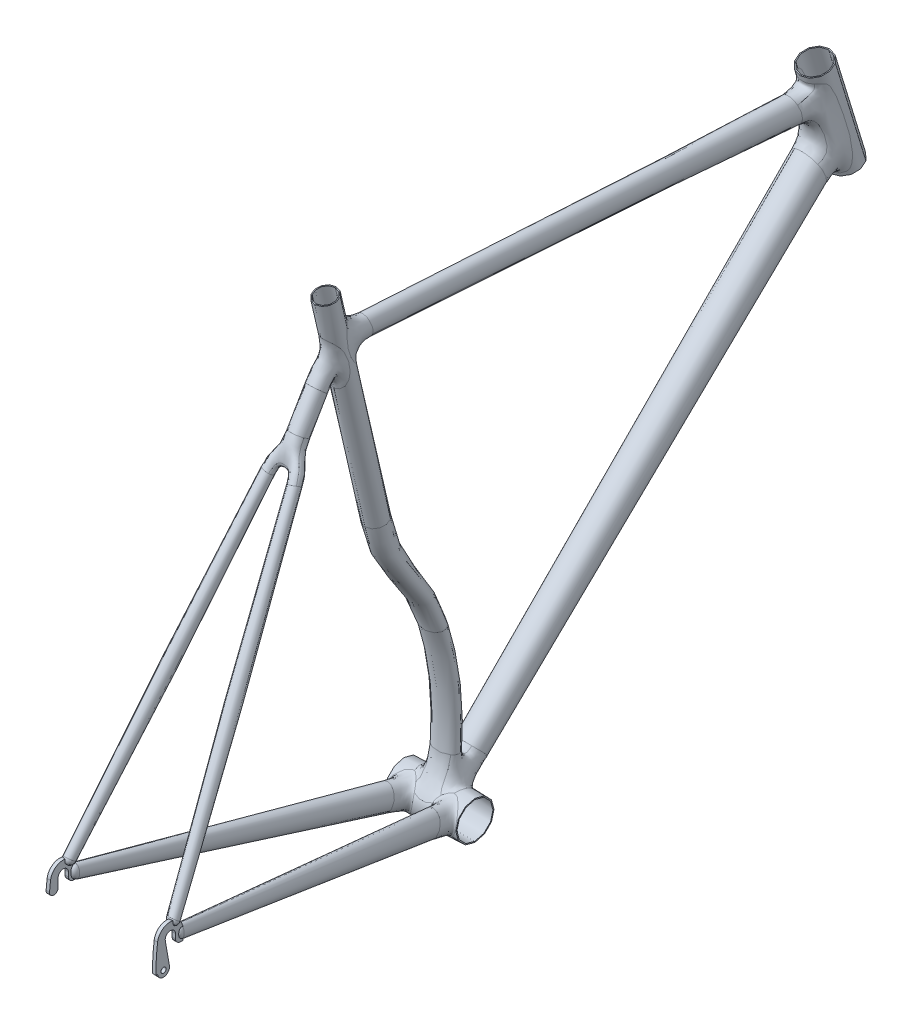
SolidWorks part; units mm, degrees
other "Dropout, Right"
other "Dropout, Left"
other "Head Tube"
other "Down Tube"
other "Seat Tube, Upper "
other "Seat Tube, Lower "
other "Bottom Bracket"
other "Top Tube"
other "Seat Stay, Left"
other "Seat Stay, Right"
other "Chain Stay, Left"
other "Chain Stay, Right"
ref_plane "Front Plane" through (0, 0, 0) normal (0, 0, 1) x (1, 0, 0)
ref_plane "Top Plane" through (0, 0, 0) normal (0, 1, 0) x (1, 0, 0)
ref_plane "Right Plane" through (0, 0, 0) normal (1, 0, 0) x (0, 0, -1)
sketch "Tube Centerlines" plane through (0, 0, 0) normal (1, 0, 0) x (0, 0, -1)
  line L0 (378.0551, 266.7) -> (837.7165, 719.7458)
  line L1 (378.0551, 266.7) -> (435.3368, 463.7667) construction
  line L2 (851.0837, 676.0236) -> (815.4378, 792.6162)
  line L3 (378.0551, 266.7) -> (0, 350)
  line L4 (0, 350) -> (256.6378, 792.6162)
  line L5 (256.6378, 792.6162) -> (826.5771, 756.181)
  line L6 (256.6378, 792.6162) -> (378.0551, 266.7) construction
  line L7 (0, 55) -> (0, -55) construction
  dimension "D1" = 45.72
  dimension "D2" = 38.1
  dimension "D3" = 38.1
  dimension "D4" = 72.32
  dimension "D5" = 116.448
  dimension "D6" = 122.989
  dimension "D7" = 539.75
  dimension "D8" = 17
imported_body "Tube Cap 1"
imported_body "Tube Cap 2"
imported_body "Tube Cap 3"
imported_body "Tube Cap 4"
imported_body "Chain Stay, Left"
imported_body "Seat Stay, Left"
imported_body "Chain Stay, Right"
imported_body "Seat Stay, Right"
imported_body "Seat Stay, Center"
imported_body "Top Tube"
imported_body "Bottom Bracket"
imported_body "Seat Tube, Lower"
imported_body "Seat Tube, Upper"
imported_body "Down Tube"
imported_body "Head Tube"
imported_body "Dropout, Right"
imported_body "Dropout, Left"
surface "Chain Stay, Right Knit"
surface "Chain Stay, Left Knit"
surface "Seat Stay, Right Knit"
surface "Seat Stay, Left Knit"
ref_plane "Plane1" through (0, 368.5924, -107.1393) normal (0, 0.9603, -0.2791) x (1, 0, 0)
sketch "Upper Seat Tube Blend" plane through (0, 0, 0) normal (1, 0, 0) x (0, 0, -1)
  line L0 (269.5687, 821.0693) -> (283.2907, 761.6327) construction
  line L1 (303.7763, 588.437) -> (245.2103, 842.1142) construction
  line L2 (285.8531, 812.7692) -> (294.2886, 776.2314)
  line L4 (256.6378, 792.6162) -> (826.5771, 756.181) construction
  line L5 (256.6378, 792.6162) -> (378.0551, 266.7) construction
  line L6 (259.1346, 787.3581) -> (293.7247, 795.3439) construction
  ellipse E0 centre (276.4297, 791.351) end of major axis (269.5687, 821.0693) minor radius 17.75 (285.8531, 812.7692) -> (294.2886, 776.2314) ccw
  dimension "D1" = 61
  dimension "D2" = 35.5
  dimension "D3" = 19
  dimension "D4" = 33
sketch "Head Tube Blend" plane through (0, 0, 0) normal (1, 0, 0) x (0, 0, -1)
  arc A0 (782.7914, 778.2013) -> (785.9539, 768.5651) centre (627.0633, 721.7563) cw
  arc A1 (796.4719, 717.05) -> (803.6708, 702.9583) centre (634.0743, 625.2026) cw
  arc A2 (785.9539, 768.5651) -> (790.675, 747.6116) centre (627.0633, 721.7563) cw
  arc A3 (790.675, 747.6116) -> (792.0611, 736.3508) centre (627.0633, 721.7563) cw
  arc A4 (803.6708, 702.9583) -> (813.5251, 676.2549) centre (634.0743, 625.2026) cw
  arc A5 (813.5251, 676.2549) -> (816.3144, 665.1709) centre (634.0743, 625.2026) cw
  spline S0 degree 3 poles (791.0459, 779.6038) (795.7312, 780.3476) (800.4165, 781.0915) (804.099, 781.4265) knots 0 0 0 0 0.078134 0.078134 0.078134 0.078134
  spline S1 degree 3 poles (835.129, 674.9911) (832.3021, 673.2012) (824.3083, 669.186) (816.3144, 665.1709) knots 0.926015 0.926015 0.926015 0.926015 1 1 1 1
  spline S2 degree 3 poles (804.099, 781.4265) (810.9979, 782.0541) (819.3231, 775.748) (833.5498, 733.4658) (841.4995, 708.3482) (842.9574, 680.3232) (837.172, 676.2847) (835.129, 674.9911) knots 0.078134 0.078134 0.078134 0.078134 0.166979 0.457547 0.746011 0.872546 0.926015 0.926015 0.926015 0.926015
sketch "Lower Seat Tube Blend" plane through (0, 0, 0) normal (1, 0, 0) x (0, 0, -1)
  line L0 (399.2769, 319.0604) -> (406.245, 311.9906)
  line L1 (353.8646, 319.0555) -> (379.1969, 317.6256)
  line L3 (406.245, 311.9906) -> (422.9164, 295.0757)
  line L4 (422.9164, 295.0757) -> (430.2528, 287.6322)
  line L5 (393.6721, 316.8086) -> (398.9212, 316.5123)
  line L6 (379.1969, 317.6256) -> (393.6721, 316.8086)
  line L7 (378.0551, 266.7) -> (837.7165, 719.7458) construction
sketch "Bottom Bracket Blend" plane through (0, -383.8478, -2695.7663) normal (0, -0.9603, 0.2791) x (1, 0, 0)
  line L2 (0, 2438.9275) -> (0, 2375.4275) construction
  line L3 (0, 2365.4934) -> (0, 3026.0392) construction
  line L5 (-25, 2407.1775) -> (25, 2407.1775) construction
  ellipse E0 centre (0, 2407.1775) end of major axis (0, 2375.4275) minor radius 25 (-17.282, 2430.1197) -> (-17.282, 2384.2354) ccw
  ellipse E1 centre (0, 2407.1775) end of major axis (0, 2438.9275) minor radius 25 (17.282, 2430.1197) -> (-17.282, 2430.1197) ccw
  ellipse E2 centre (0, 2407.1775) end of major axis (0, 2438.9275) minor radius 25 (-17.282, 2384.2354) -> (17.282, 2384.2354) ccw
  ellipse E3 centre (0, 2407.1775) end of major axis (0, 2438.9275) minor radius 25 (17.282, 2384.2354) -> (17.282, 2430.1197) ccw
  dimension "D1" = 50
  dimension "D2" = 63.5
surface "Surface-Trim1"
surface "Surface-Loft1"
surface "Surface-Trim2"
other "Boundary-Surface1"
other "Boundary-Surface2"
other "Boundary-Surface3"
surface "Surface-Fill1"
mirror "Mirror1" about plane through (0, 0, 0) normal (1, 0, 0)
surface "Surface-Knit1"
surface "Surface-Trim3"
wrap "Wrap1" sketch "Bottom Bracket Blend" wrap type scribe source sketch "Bottom Bracket Blend"
other "DeleteFace1"
surface "Surface-Loft2"
surface "Surface-Loft3"
surface "Surface-Loft4"
surface "Surface-Fill2"
surface "Surface-Fill3"
surface "Surface-Knit2"
sketch "Seat Stay Blend " plane through (0, 0, 0) normal (1, 0, 0) x (0, 0, -1)
  line L0 (216.1796, 768.997) -> (250.7204, 741.8761)
  ellipse E0 centre (237.7358, 772.3537) end of major axis (224.5435, 802.7431) minor radius 21.4077 (216.1796, 768.997) -> (250.7204, 741.8761) cw
surface "Surface-Loft5"
surface "Surface-Trim4"
surface "Surface-Loft6"
ref_plane "Seat Stay Plane" through (0, 88.0615, 151.8772) normal (0, -0.5016, -0.8651) x (0, 0.8651, -0.5016)
sketch "Sketch1" plane through (0, 88.0615, 151.8772) normal (0, -0.5016, -0.8651) x (0, 0.8651, -0.5016)
  line L0 (729, -26.7548) -> (729, -9.5)
  line L1 (729, 0) -> (677.9631, 0) construction
  line L2 (814.4212, 0) -> (420.3549, 0) construction
  line L3 (695.2932, -41.2838) -> (690.0804, -20.3762)
  line L4 (690.0804, 20.3762) -> (687.6611, 10.6733)
  line L5 (729, 9.5) -> (729, 26.7548)
  line L6 (729, -9.5) -> (729, 9.5)
  line L7 (687.6611, 10.6733) -> (685, 0)
  line L8 (695.2932, 41.2838) -> (690.0804, 20.3762)
  line L9 (687.6611, -10.6733) -> (685, 0)
  line L10 (690.0804, -20.3762) -> (687.6611, -10.6733)
  dimension "D1" = 76
  dimension "D2" = 44
  dimension "D3" = 685
  dimension "D4" = 19
  dimension "D5" = 11
  dimension "D6" = 21
surface "Surface-Trim5"
other "Boundary-Surface4"
other "Boundary-Surface5"
other "Boundary-Surface6"
surface "Surface-Fill4"
surface "Surface-Fill5"
surface "Surface-Offset1" parameters "D1"=4.5
surface "Surface-Trim6"
surface "Surface-Trim7"
sketch "Sketch2" plane through (0, 0, 0) normal (1, 0, 0) x (0, 0, -1)
  line L0 (347.6944, 305.5077) -> (333.7186, 242.0789)
  line L1 (378.0551, 266.7) -> (0, 350) construction
  dimension "D1" = 38
surface "Surface-Trim8"
other "Boundary-Surface7"
other "Boundary-Surface8"
surface "Surface-Plane1"
surface "Surface-Knit3"
shell "Shell1" thickness 1.2
